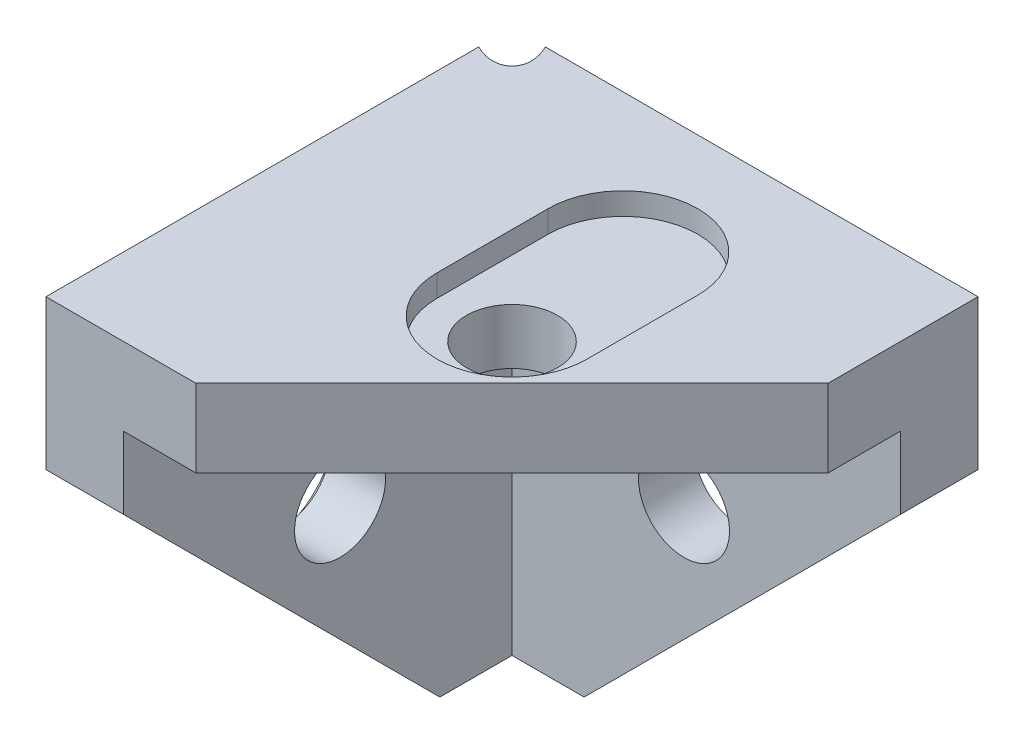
SolidWorks part; units mm, degrees
ref_plane "Front" through (0, 0, 0) normal (0, 0, 1) x (1, 0, 0)
ref_plane "Top" through (0, 0, 0) normal (0, 1, 0) x (1, 0, 0)
ref_plane "Right" through (0, 0, 0) normal (1, 0, 0) x (0, 0, -1)
imported_body "Imported1"
sketch "Sketch1" plane through (0, 0, 0) normal (0, 1, 0) x (1, 0, 0)
  line L0 (42, -13.5) -> (13.5, -42)
  line L5 (42, -14) -> (42, 0)
  line L6 (42, 0) -> (3.0006, 0)
  line L7 (0, -3.0006) -> (0, -42)
  line L8 (0, -42) -> (14, -42)
  line L9 (14, -42) -> (42, -14)
  line L10 (42, -14) -> (42, 0)
  line L11 (42, 0) -> (3.0006, 0)
  line L12 (0, -3.0006) -> (0, -42)
  line L13 (0, -42) -> (14, -42)
  line L14 (14, -42) -> (42, -14)
  ellipse E1 centre (0, 0) end of major axis (-3.0006, 3.0006) minor radius 2.45 (0, -3.0006) -> (3.0006, 0) ccw
  ellipse E2 centre (0, 0) end of major axis (-3.0006, 3.0006) minor radius 2.45 (0, -3.0006) -> (3.0006, 0) ccw
  dimension "D2" = 13.5
  dimension "D1" = 0
extrude "Extrude1" cut sketch "Sketch1" against normal blind 10 contours L0 M11 M15 M16
sketch "Sketch2" plane through (0, 0, 0) normal (0, 0, -1) x (-1, 0, 0)
  line L0 (-13.5, -42) -> (-42, -13.5)
  line L5 (-3.0006, 0) -> (-42, 0)
  line L6 (-42, 0) -> (-42, -14)
  line L7 (-42, -14) -> (-14, -42)
  line L8 (-14, -42) -> (0, -42)
  line L9 (0, -42) -> (0, -3.0006)
  line L10 (-3.0006, 0) -> (-42, 0)
  line L11 (-42, 0) -> (-42, -14)
  line L12 (-42, -14) -> (-14, -42)
  line L13 (-14, -42) -> (0, -42)
  line L14 (0, -42) -> (0, -3.0006)
  ellipse E1 centre (0, 0) end of major axis (3.0006, 3.0006) minor radius 2.45 (-3.0006, 0) -> (0, -3.0006) ccw
  ellipse E2 centre (0, 0) end of major axis (3.0006, 3.0006) minor radius 2.45 (-3.0006, 0) -> (0, -3.0006) ccw
  dimension "D2" = 13.5
  dimension "D1" = 0
extrude "Extrude2" cut sketch "Sketch2" against normal blind 10 contours L0 M14 M12 M13
sketch "Sketch3" plane through (0, 0, 0) normal (-1, 0, 0) x (0, 0, 1)
  line L0 (42, -13.5) -> (13.5, -42)
  line L5 (42, -14) -> (42, 0)
  line L6 (42, 0) -> (3.0006, 0)
  line L7 (0, -3.0006) -> (0, -42)
  line L8 (0, -42) -> (14, -42)
  line L9 (14, -42) -> (42, -14)
  line L10 (42, -14) -> (42, 0)
  line L11 (42, 0) -> (3.0006, 0)
  line L12 (0, -3.0006) -> (0, -42)
  line L13 (0, -42) -> (14, -42)
  line L14 (14, -42) -> (42, -14)
  ellipse E1 centre (0, 0) end of major axis (-3.0006, 3.0006) minor radius 2.45 (0, -3.0006) -> (3.0006, 0) ccw
  ellipse E2 centre (0, 0) end of major axis (-3.0006, 3.0006) minor radius 2.45 (0, -3.0006) -> (3.0006, 0) ccw
  dimension "D2" = 13.5
  dimension "D1" = 0
extrude "Extrude3" cut sketch "Sketch3" against normal blind 10 contours L0 M11 M15 M16
